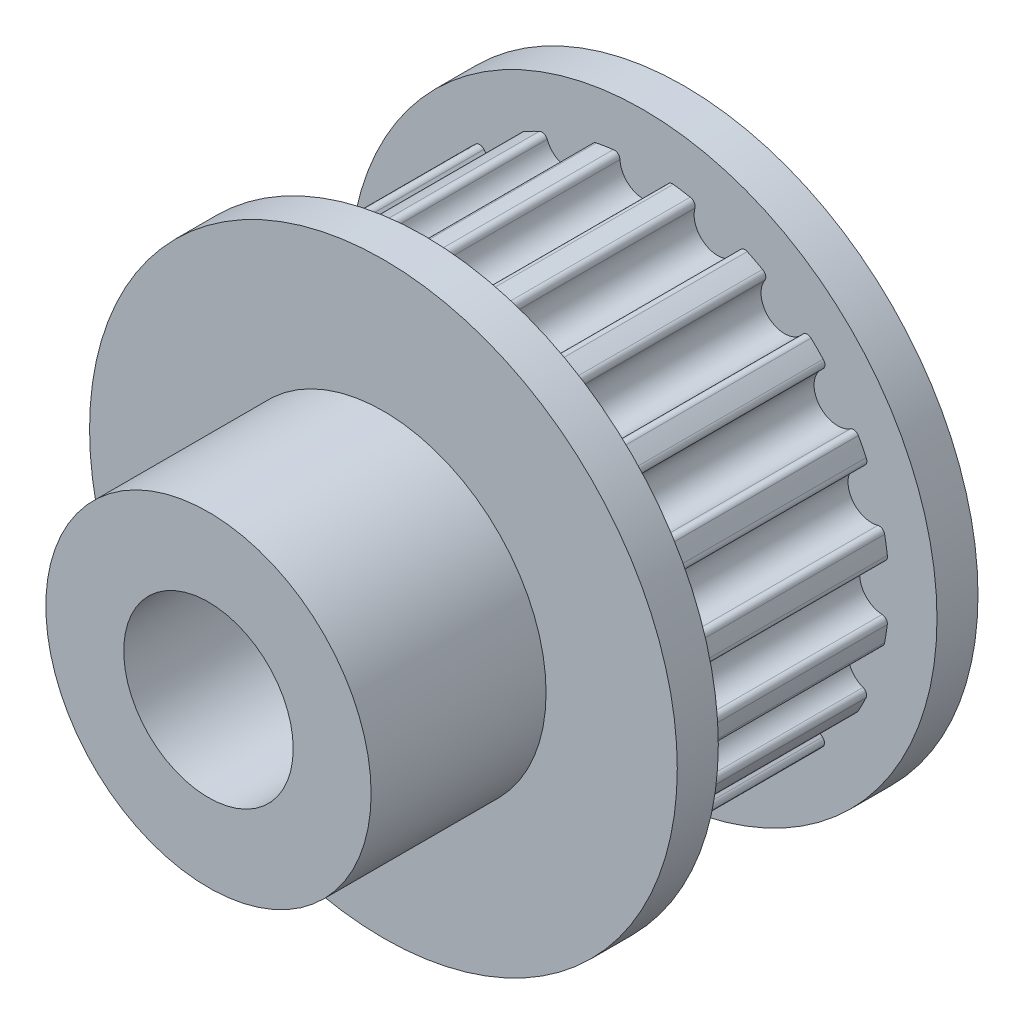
SolidWorks part; units mm, degrees
ref_plane "Plano frontal" through (0, 0, 0) normal (0, 0, 1) x (1, 0, 0)
ref_plane "Plano superior" through (0, 0, 0) normal (0, 1, 0) x (1, 0, 0)
ref_plane "Plano direito" through (0, 0, 0) normal (1, 0, 0) x (0, 0, -1)
sketch "Sketch1" plane through (0, 0, 0) normal (0, 0, 1) x (1, 0, 0)
  circle A0 centre (0, 0) radius 3.1
  circle A1 centre (0, 0) radius 5.95
  dimension "D1" = 6.2
  dimension "D2" = 11.9
extrude "Boss-Extrude1" add sketch "Sketch1" along normal blind 17.4
sketch "Sketch2" plane through (0, 0, 0) normal (0, 0, 1) x (1, 0, 0)
  circle A0 centre (0, 0) radius 5.95
  circle A1 centre (0, 0) radius 10.75
  dimension "D1" = 21.5
extrude "Boss-Extrude2" add sketch "Sketch2" along normal blind 1.5
sketch "Sketch4" plane through (0, 0, 1.5) normal (0, 0, 1) x (1, 0, 0)
  arc A0 (1.1025, 8.9322) -> (1.7215, 8.8338) centre (0, 0) cw
  arc A1 (-0.8469, 8.7426) -> (0.8754, 8.7426) centre (0.0143, 8.7839) ccw
  arc A2 (1.8962, 8.5764) -> (3.5342, 8.0442) centre (2.728, 8.3496) ccw
  arc A3 (1.8962, 8.5764) -> (1.7215, 8.8338) centre (1.699, 8.6305) ccw
  arc A4 (3.5342, 8.0442) -> (3.8088, 8.1543) centre (3.7221, 7.973) cw
  arc A5 (3.8088, 8.1543) -> (4.3671, 7.8695) centre (0, 0) cw
  arc A6 (4.4537, 7.5707) -> (5.847, 6.5584) centre (5.1746, 7.0979) ccw
  arc A7 (4.4537, 7.5707) -> (4.3671, 7.8695) centre (4.2828, 7.6831) ccw
  arc A8 (5.847, 6.5584) -> (6.1422, 6.5783) centre (6.0038, 6.4326) cw
  arc A9 (6.1422, 6.5783) -> (6.5851, 6.1348) centre (0, 0) cw
  arc A10 (6.5752, 5.8239) -> (7.5875, 4.4305) centre (7.1147, 5.1515) ccw
  arc A11 (6.5752, 5.8239) -> (6.5851, 6.1348) centre (6.4474, 5.9836) ccw
  arc A12 (7.5875, 4.4305) -> (7.8744, 4.3583) centre (7.6977, 4.2625) cw
  arc A13 (7.8744, 4.3583) -> (8.1586, 3.7997) centre (0, 0) cw
  arc A14 (8.053, 3.507) -> (8.5853, 1.869) centre (8.3584, 2.7008) ccw
  arc A15 (8.053, 3.507) -> (8.1586, 3.7997) centre (7.9809, 3.6984) ccw
  arc A16 (8.5853, 1.869) -> (8.8357, 1.7117) centre (8.6381, 1.6752) cw
  arc A17 (8.8357, 1.7117) -> (8.9334, 1.0925) centre (0, 0) cw
  arc A18 (8.7426, 0.8469) -> (8.7426, -0.8754) centre (8.7839, -0.0143) ccw
  arc A19 (8.7426, 0.8469) -> (8.9334, 1.0925) centre (8.7331, 1.0512) ccw
  arc A20 (8.7426, -0.8754) -> (8.9322, -1.1025) centre (8.733, -1.0761) cw
  arc A21 (0.8754, 8.7426) -> (1.1025, 8.9322) centre (1.0761, 8.733) cw
  arc A22 (-0.8469, 8.7426) -> (-1.0925, 8.9334) centre (-1.0512, 8.7331) ccw
  arc A23 (8.9322, -1.1025) -> (8.8338, -1.7215) centre (0, 0) cw
  arc A24 (8.5764, -1.8962) -> (8.0442, -3.5342) centre (8.3496, -2.728) ccw
  arc A25 (8.5764, -1.8962) -> (8.8338, -1.7215) centre (8.6305, -1.699) ccw
  arc A26 (8.0442, -3.5342) -> (8.1543, -3.8088) centre (7.973, -3.7221) cw
  arc A27 (8.1543, -3.8088) -> (7.8695, -4.3671) centre (0, 0) cw
  arc A28 (7.5707, -4.4537) -> (6.5584, -5.847) centre (7.0979, -5.1746) ccw
  arc A29 (7.5707, -4.4537) -> (7.8695, -4.3671) centre (7.6831, -4.2828) ccw
  arc A30 (6.5584, -5.847) -> (6.5783, -6.1422) centre (6.4326, -6.0038) cw
  arc A31 (6.5783, -6.1422) -> (6.1348, -6.5851) centre (0, 0) cw
  arc A32 (5.8239, -6.5752) -> (4.4305, -7.5875) centre (5.1515, -7.1147) ccw
  arc A33 (5.8239, -6.5752) -> (6.1348, -6.5851) centre (5.9836, -6.4474) ccw
  arc A34 (4.4305, -7.5875) -> (4.3583, -7.8744) centre (4.2625, -7.6977) cw
  arc A35 (4.3583, -7.8744) -> (3.7997, -8.1586) centre (0, 0) cw
  arc A36 (3.507, -8.053) -> (1.869, -8.5853) centre (2.7008, -8.3584) ccw
  arc A37 (3.507, -8.053) -> (3.7997, -8.1586) centre (3.6984, -7.9809) ccw
  arc A38 (1.869, -8.5853) -> (1.7117, -8.8357) centre (1.6752, -8.6381) cw
  arc A39 (1.7117, -8.8357) -> (1.0925, -8.9334) centre (0, 0) cw
  arc A40 (0.8469, -8.7426) -> (-0.8754, -8.7426) centre (-0.0143, -8.7839) ccw
  arc A41 (0.8469, -8.7426) -> (1.0925, -8.9334) centre (1.0512, -8.7331) ccw
  arc A42 (-0.8754, -8.7426) -> (-1.1025, -8.9322) centre (-1.0761, -8.733) cw
  arc A43 (-1.1025, -8.9322) -> (-1.7215, -8.8338) centre (0, 0) cw
  arc A44 (-1.8962, -8.5764) -> (-3.5342, -8.0442) centre (-2.728, -8.3496) ccw
  arc A45 (-1.8962, -8.5764) -> (-1.7215, -8.8338) centre (-1.699, -8.6305) ccw
  arc A46 (-3.5342, -8.0442) -> (-3.8088, -8.1543) centre (-3.7221, -7.973) cw
  arc A47 (-3.8088, -8.1543) -> (-4.3671, -7.8695) centre (0, 0) cw
  arc A48 (-4.4537, -7.5707) -> (-5.847, -6.5584) centre (-5.1746, -7.0979) ccw
  arc A49 (-4.4537, -7.5707) -> (-4.3671, -7.8695) centre (-4.2828, -7.6831) ccw
  arc A50 (-5.847, -6.5584) -> (-6.1422, -6.5783) centre (-6.0038, -6.4326) cw
  arc A51 (-6.1422, -6.5783) -> (-6.5851, -6.1348) centre (0, 0) cw
  arc A52 (-6.5752, -5.8239) -> (-7.5875, -4.4305) centre (-7.1147, -5.1515) ccw
  arc A53 (-6.5752, -5.8239) -> (-6.5851, -6.1348) centre (-6.4474, -5.9836) ccw
  arc A54 (-7.5875, -4.4305) -> (-7.8744, -4.3583) centre (-7.6977, -4.2625) cw
  arc A55 (-7.8744, -4.3583) -> (-8.1586, -3.7997) centre (0, 0) cw
  arc A56 (-8.053, -3.507) -> (-8.5853, -1.869) centre (-8.3584, -2.7008) ccw
  arc A57 (-8.053, -3.507) -> (-8.1586, -3.7997) centre (-7.9809, -3.6984) ccw
  arc A58 (-8.5853, -1.869) -> (-8.8357, -1.7117) centre (-8.6381, -1.6752) cw
  arc A59 (-8.8357, -1.7117) -> (-8.9334, -1.0925) centre (0, 0) cw
  arc A60 (-8.7426, -0.8469) -> (-8.7426, 0.8754) centre (-8.7839, 0.0143) ccw
  arc A61 (-8.7426, -0.8469) -> (-8.9334, -1.0925) centre (-8.7331, -1.0512) ccw
  arc A62 (-8.7426, 0.8754) -> (-8.9322, 1.1025) centre (-8.733, 1.0761) cw
  arc A63 (-8.9322, 1.1025) -> (-8.8338, 1.7215) centre (0, 0) cw
  arc A64 (-8.5764, 1.8962) -> (-8.0442, 3.5342) centre (-8.3496, 2.728) ccw
  arc A65 (-8.5764, 1.8962) -> (-8.8338, 1.7215) centre (-8.6305, 1.699) ccw
  arc A66 (-8.0442, 3.5342) -> (-8.1543, 3.8088) centre (-7.973, 3.7221) cw
  arc A67 (-8.1543, 3.8088) -> (-7.8695, 4.3671) centre (0, 0) cw
  arc A68 (-7.5707, 4.4537) -> (-6.5584, 5.847) centre (-7.0979, 5.1746) ccw
  arc A69 (-7.5707, 4.4537) -> (-7.8695, 4.3671) centre (-7.6831, 4.2828) ccw
  arc A70 (-6.5584, 5.847) -> (-6.5783, 6.1422) centre (-6.4326, 6.0038) cw
  arc A71 (-6.5783, 6.1422) -> (-6.1348, 6.5851) centre (0, 0) cw
  arc A72 (-5.8239, 6.5752) -> (-4.4305, 7.5875) centre (-5.1515, 7.1147) ccw
  arc A73 (-5.8239, 6.5752) -> (-6.1348, 6.5851) centre (-5.9836, 6.4474) ccw
  arc A74 (-4.4305, 7.5875) -> (-4.3583, 7.8744) centre (-4.2625, 7.6977) cw
  arc A75 (-4.3583, 7.8744) -> (-3.7997, 8.1586) centre (0, 0) cw
  arc A76 (-3.507, 8.053) -> (-1.869, 8.5853) centre (-2.7008, 8.3584) ccw
  arc A77 (-3.507, 8.053) -> (-3.7997, 8.1586) centre (-3.6984, 7.9809) ccw
  arc A78 (-1.869, 8.5853) -> (-1.7117, 8.8357) centre (-1.6752, 8.6381) cw
  arc A79 (-1.7117, 8.8357) -> (-1.0925, 8.9334) centre (0, 0) cw
  circle A80 centre (0, 0) radius 5.95
  point P65 (0, 0)
  point P146 (0, 0)
  point P166 (0, 0)
  dimension "D1" = 20
extrude "Boss-Extrude3" add sketch "Sketch4" along normal blind 8
sketch "Sketch6" plane through (0, 0, 9.5) normal (0, 0, 1) x (1, 0, 0)
  circle A0 centre (0, 0) radius 5.95
  circle A1 centre (0, 0) radius 10.75
extrude "Boss-Extrude4" add sketch "Sketch6" along normal blind 1.5
